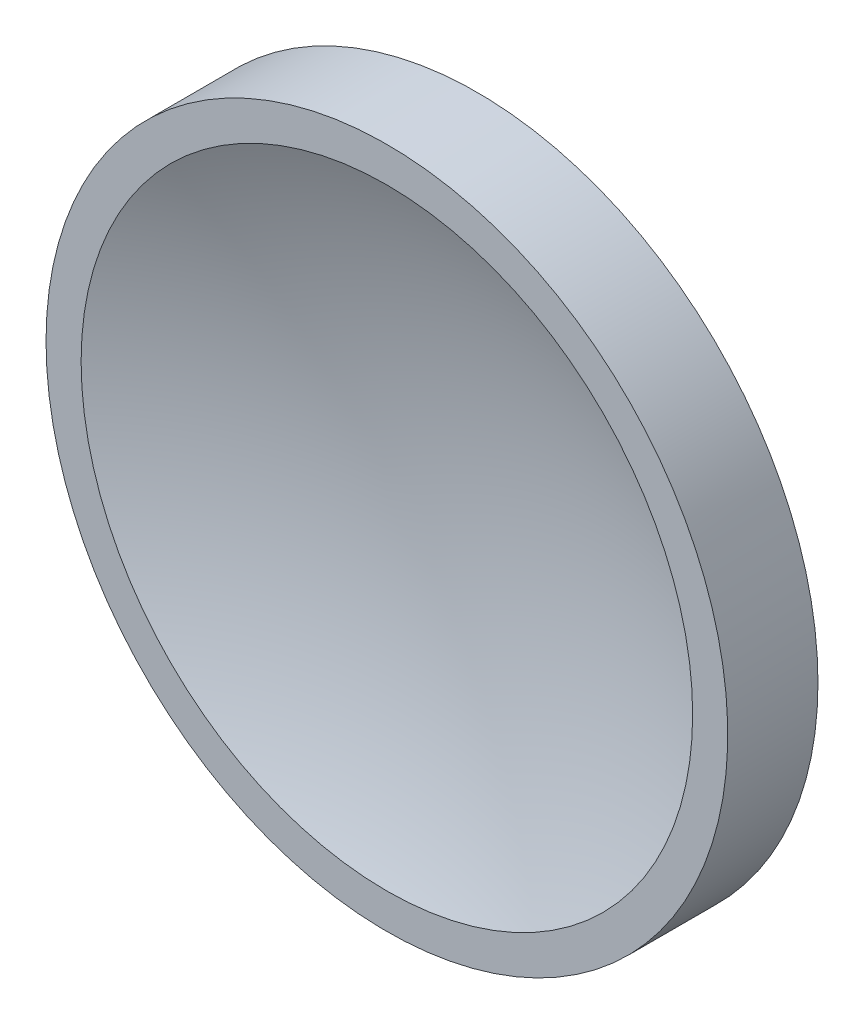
SolidWorks part; units mm, degrees
ref_plane "Front Plane" through (0, 0, 0) normal (0, 0, 1) x (1, 0, 0)
ref_plane "Top Plane" through (0, 0, 0) normal (0, 1, 0) x (1, 0, 0)
ref_plane "Right Plane" through (0, 0, 0) normal (1, 0, 0) x (0, 0, -1)
sketch "Sketch1" plane through (0, 0, 0) normal (0, 0, 1) x (1, 0, 0)
  circle A0 centre (0, 0) radius 17
  dimension "D1" = 34
extrude "Boss-Extrude1" add sketch "Sketch1" along normal blind 5.288
sketch "Sketch2" plane through (0, 0, 0) normal (0, 1, 0) x (1, 0, 0)
  line L0 (17, 0) -> (0, 0)
  line L1 (0, 0) -> (0, 2.6602)
  arc A0 (17, 0) -> (-17, 0) centre (0, -52.9888) ccw construction
  arc A1 (0, 2.6602) -> (17, 0) centre (0, -52.9888) cw
  dimension "D1" = 55.649
revolve "Revolve1" add sketch "Sketch2" angle 360 about L1
sketch "Sketch3" plane through (0, 0, 0) normal (0, 1, 0) x (1, 0, 0)
  line L0 (0, -1.4178) -> (0, -5.288)
  line L1 (-17, -5.288) -> (17, -5.288) construction
  line L2 (0, -5.288) -> (17, -5.288)
  arc A0 (17, -5.288) -> (-17, -5.288) centre (0, -40.6898) ccw construction
  arc A1 (0, -1.4178) -> (17, -5.288) centre (0, -40.6898) cw
  dimension "D1" = 39.272
revolve "Cut-Revolve3" cut sketch "Sketch3" angle 360 about L0
ref_plane "Plane1" through (0, 0, -2.6602) normal (0, 0, -1) x (-1, 0, 0)
ref_plane "Plane2" through (0, 0, 1.4178) normal (0, 0, 1) x (1, 0, 0)
sketch "Sketch4" plane through (0, 0, 0) normal (0, 1, 0) x (1, 0, 0)
  line L0 (-17, -5.288) -> (17, -5.288) construction
  line L1 (-17, -5.288) -> (-15.25, -5.288)
  line L2 (-17, -5.288) -> (-17, -4.4997)
  line L3 (-17, -4.4997) -> (-15.25, -4.4997)
  line L4 (-15.25, -5.288) -> (-15.25, -4.4997)
  line L5 (0, 0) -> (0, -50000) construction
  arc A0 (17, -5.288) -> (-17, -5.288) centre (0, -40.6898) ccw construction
  dimension "D3" = 39.272
  dimension "D1" = 15.25
  dimension "D4" = 34
revolve "Cut-Revolve4" cut sketch "Sketch4" angle 360 about L5
